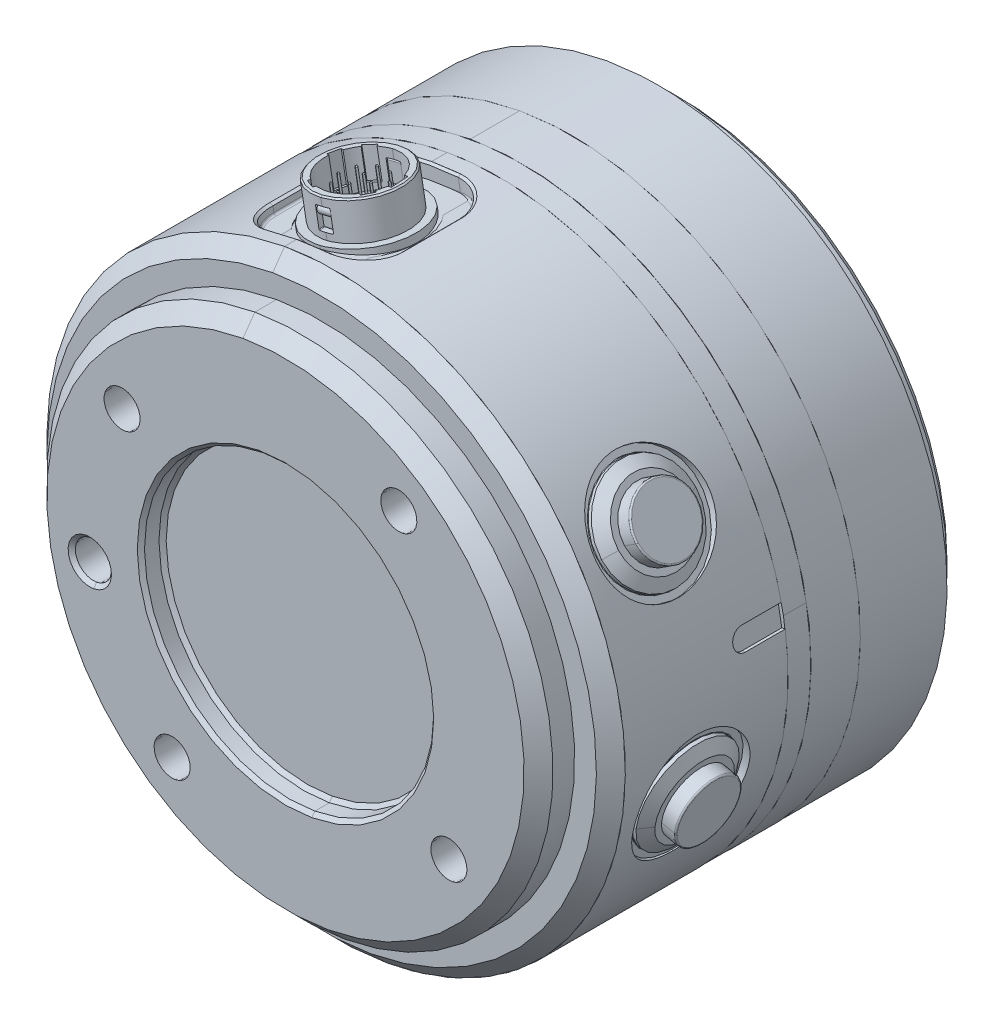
SolidWorks part; units mm, degrees
ref_plane "前视基准面" through (0, 0, 0) normal (0, 0, 1) x (1, 0, 0)
ref_plane "上视基准面" through (0, 0, 0) normal (0, 1, 0) x (1, 0, 0)
ref_plane "右视基准面" through (0, 0, 0) normal (1, 0, 0) x (0, 0, -1)
imported_body "TCR030-J6.STEP"
hole_wizard "M6 螺纹孔的螺纹孔钻头1" positions "草图2" profile "草图3" hole size "M6" standard "GB"
sketch "草图2" plane through (0, 0, 202.085) normal (0, 0, 1) x (1, 0, 0)
  point P0 (13.6641, 67.1243)
  point P3 (51.9336, 74.0481)
  point P6 (58.8575, 35.7786)
  point P9 (20.5879, 28.8547)
sketch "草图3" plane through (13.6641, 67.1243, 202.085) normal (1, 0, 0) x (0, -1, 0)
  line L0 (0, 0) -> (0, 9.5022)
  line L1 (0, 9.5022) -> (2.5, 8)
  line L2 (2.5, 8) -> (2.5, 0)
  line L5 (2.5, 0) -> (0, 0)
  line L10 (0, 9.5022) -> (-2.5, 8) construction
  line L11 (0, -6.35) -> (0, 107.95) construction
  dimension "孔直径" = 5
  dimension "孔深度" = 8
  dimension "导头角度" = 118
hole_wizard "大小mm 暗销孔1" positions "草图4" profile "草图5" hole size "Ø5.0" standard "GB"
sketch "草图4" plane through (0, 0, 202.085) normal (0, 0, 1) x (1, 0, 0)
  point P0 (9.2001, 46.5555)
sketch "草图5" plane through (9.2001, 46.5555, 202.085) normal (1, 0, 0) x (0, -1, 0)
  line L0 (0, 0) -> (0, 8.5022)
  line L1 (0, 8.5022) -> (2.5, 7)
  line L2 (2.5, 7) -> (2.5, 0)
  line L5 (2.5, 0) -> (0, 0)
  line L10 (0, 8.5022) -> (-2.5, 7) construction
  line L11 (0, -6.35) -> (0, 107.95) construction
  dimension "孔直径" = 5
  dimension "孔深度" = 7
  dimension "导头角度" = 118
sketch "草图6" plane through (0, 0, 162.585) normal (0, 0, -1) x (-1, 0, 0)
  circle A0 centre (-36.2608, 51.4514) radius 38
  arc A2 (-29.1394, 90.8124) -> (-43.3821, 12.0904) centre (-36.2608, 51.4514) ccw
  arc A3 (-43.3821, 12.0904) -> (-29.1394, 90.8124) centre (-36.2608, 51.4514) ccw
  arc A4 (-29.1394, 90.8124) -> (-43.3821, 12.0904) centre (-36.2608, 51.4514) ccw
  arc A5 (-43.3821, 12.0904) -> (-29.1394, 90.8124) centre (-36.2608, 51.4514) ccw
  dimension "D1" = 0
extrude "凸台-拉伸1" add sketch "草图6" along normal blind 12 separate body
fillet "圆角1" radius 1.5 2 edges at (75.629, 57.0497, 179.585) (75.0949, 60.0018, 179.585)
